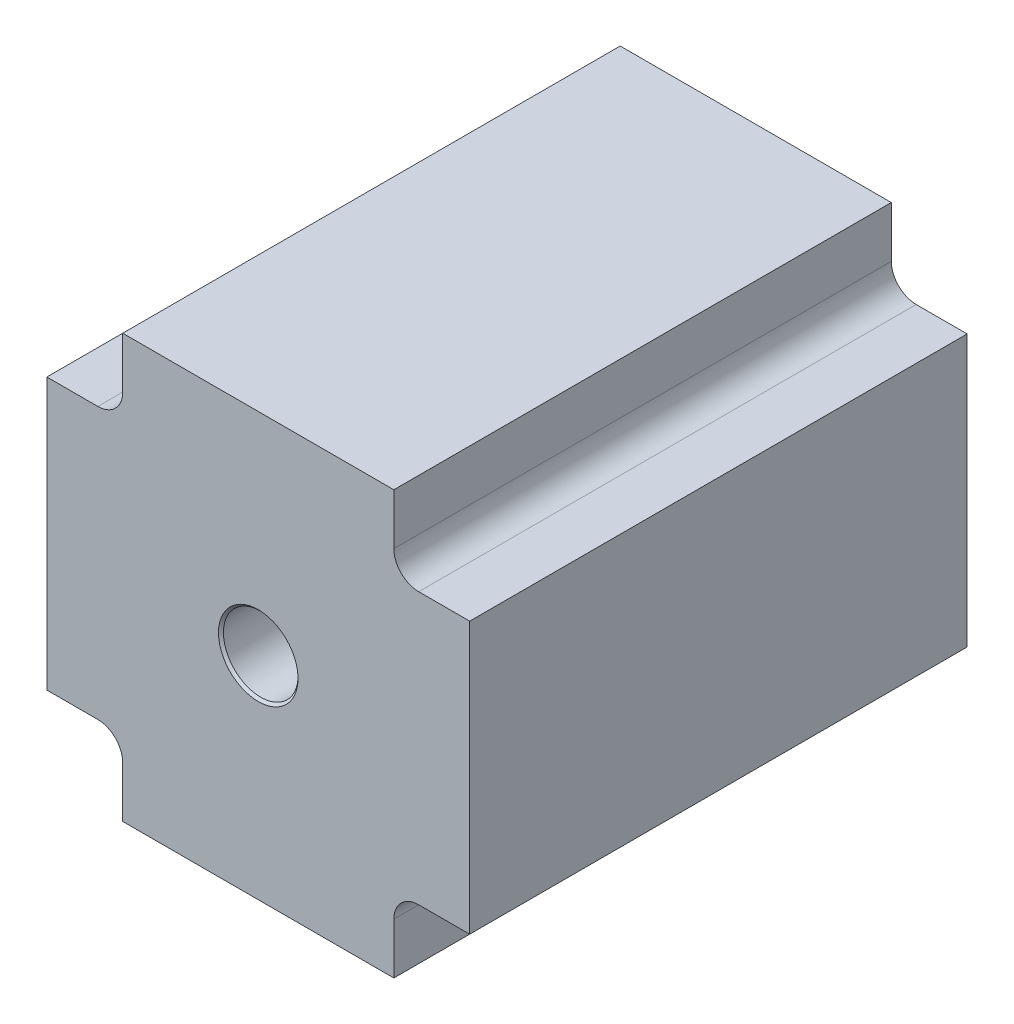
SolidWorks part; units mm, degrees
ref_plane "前视基准面" through (0, 0, 0) normal (0, 0, 1) x (1, 0, 0)
ref_plane "上视基准面" through (0, 0, 0) normal (0, 1, 0) x (1, 0, 0)
ref_plane "右视基准面" through (0, 0, 0) normal (1, 0, 0) x (0, 0, -1)
sketch "草图1" plane through (0, 0, 0) normal (0, 0, 1) x (1, 0, 0)
  line L0 (73.6849, 0) -> (-83.1554, 0) construction
  line L1 (27.25, 42.5) -> (-27.25, 42.5)
  line L2 (27.25, 42.5) -> (27.25, 27.25)
  line L3 (27.25, -42.5) -> (-27.25, -42.5)
  line L4 (-27.25, 42.5) -> (-27.25, 27.25)
  line L5 (27.25, 42.5) -> (-27.25, -42.5) construction
  line L6 (27.25, -42.5) -> (-27.25, 42.5) construction
  line L7 (0, -54.7285) -> (0, 60.804) construction
  line L8 (-27.25, 27.25) -> (-42.5, 27.25)
  line L9 (42.5, -27.25) -> (27.25, -27.25)
  line L10 (42.5, -27.25) -> (42.5, 27.25)
  line L11 (42.5, 27.25) -> (27.25, 27.25)
  line L12 (-42.5, -27.25) -> (-42.5, 27.25)
  line L13 (42.5, -27.25) -> (-42.5, 27.25) construction
  line L14 (42.5, 27.25) -> (-42.5, -27.25) construction
  line L15 (-27.25, -27.25) -> (-27.25, -42.5)
  line L16 (-27.25, -27.25) -> (-42.5, -27.25)
  line L17 (27.25, -27.25) -> (27.25, -42.5)
  point P0 (0, 0)
  point P10 (0, 0)
  dimension "D1" = 54.5
  dimension "D2" = 85
  dimension "D3" = 54.5
  dimension "D4" = 85
extrude "凸台-拉伸1" add sketch "草图1" along normal blind 100
sketch "草图3" plane through (0, 0, 100) normal (0, 0, 1) x (1, 0, 0)
  circle A0 centre (0, 0) radius 7.5
  dimension "D1" = 15
extrude "切除-拉伸2" cut sketch "草图3" against normal through all
chamfer "倒角3" distance 0.5 angle 45 2 edges at (7.5, 0, 0) (7.5, 0, 100)
fillet "圆角1" radius 5 4 edges at (-27.25, -27.25, 50) (27.25, -27.25, 50) (27.25, 27.25, 50) (-27.25, 27.25, 50)
